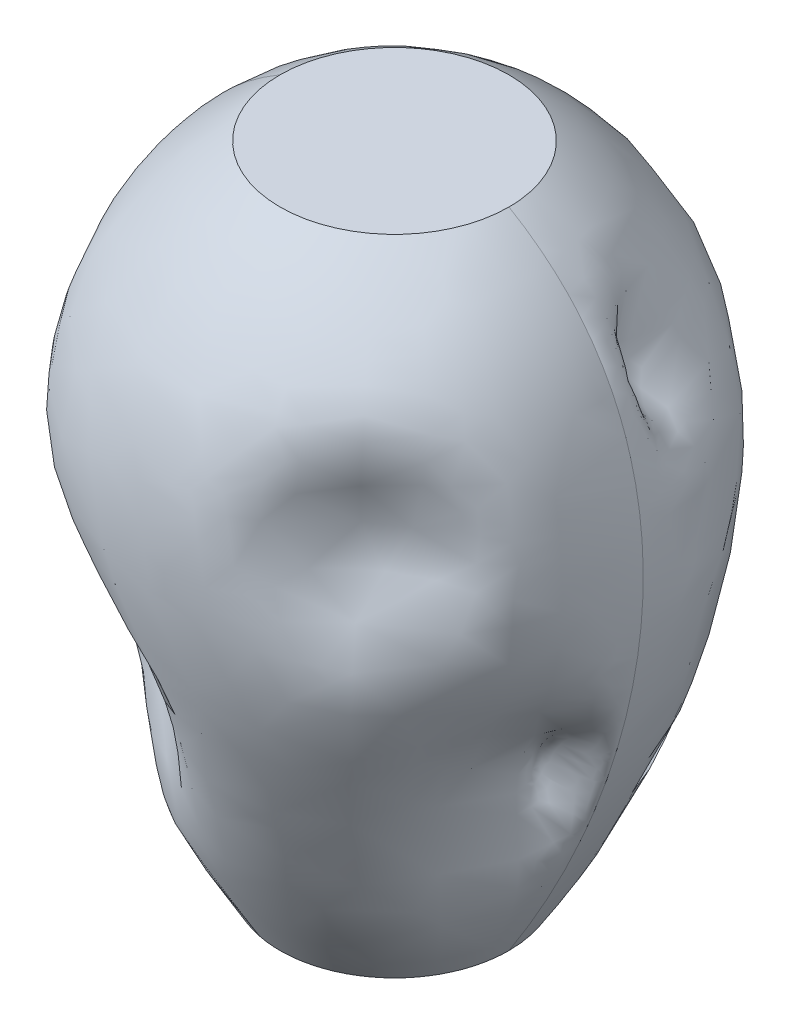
SolidWorks part; units mm, degrees
ref_plane "Alzado" through (0, 0, 0) normal (0, 0, 1) x (1, 0, 0)
ref_plane "Planta" through (0, 0, 0) normal (0, 1, 0) x (1, 0, 0)
ref_plane "Vista lateral" through (0, 0, 0) normal (1, 0, 0) x (0, 0, -1)
sketch "Croquis10" plane through (0, 0, 0) normal (0, 0, 1) x (1, 0, 0)
  line L0 (-80, 225) -> (0, 225)
  line L1 (-175, -225) -> (175, -225) construction
  line L2 (-175, -225) -> (-175, 225) construction
  line L3 (-175, 225) -> (175, 225) construction
  line L4 (175, -225) -> (175, 225) construction
  line L5 (-175, -225) -> (175, 225) construction
  line L6 (-175, 225) -> (175, -225) construction
  line L7 (0, 225) -> (0, -225)
  line L8 (0, -225) -> (-80, -225)
  spline S0 degree 3 poles (-80, -225) (-181.0474, -69.8803) (-227.0645, 139.4829) (-80, 225) knots 0 0 0 0 1 1 1 1
  point P0 (0, 0)
  dimension "D1" = 80
  dimension "D2" = 80
  dimension "D3" = 450
  dimension "D4" = 350
revolve "Revolución3" add sketch "Croquis10" angle 360 about L7
other "Deformación2" parameters "D1"=30, "D2"=10
other "Deformación3" parameters "D1"=40, "D2"=20
other "Deformación4" parameters "D1"=30, "D2"=10
other "Deformación5" parameters "D1"=30, "D2"=10
other "Deformación6" parameters "D1"=40, "D2"=20
other "Deformación7" parameters "D1"=30, "D2"=50
sketch "Croquis11" plane through (0, 0, 0) normal (0, 0, 1) x (1, 0, 0)
  line L0 (80, 225) -> (-80, 225) construction
  line L1 (-174, -225) -> (174, -225)
  line L2 (-174, -225) -> (-174, 225)
  line L3 (-174, 225) -> (174, 225)
  line L4 (174, -225) -> (174, 225)
  line L5 (-174, -225) -> (174, 225) construction
  line L6 (-174, 225) -> (174, -225) construction
  point P0 (0, 0)
  dimension "D1" = 348
  dimension "D2" = 450
